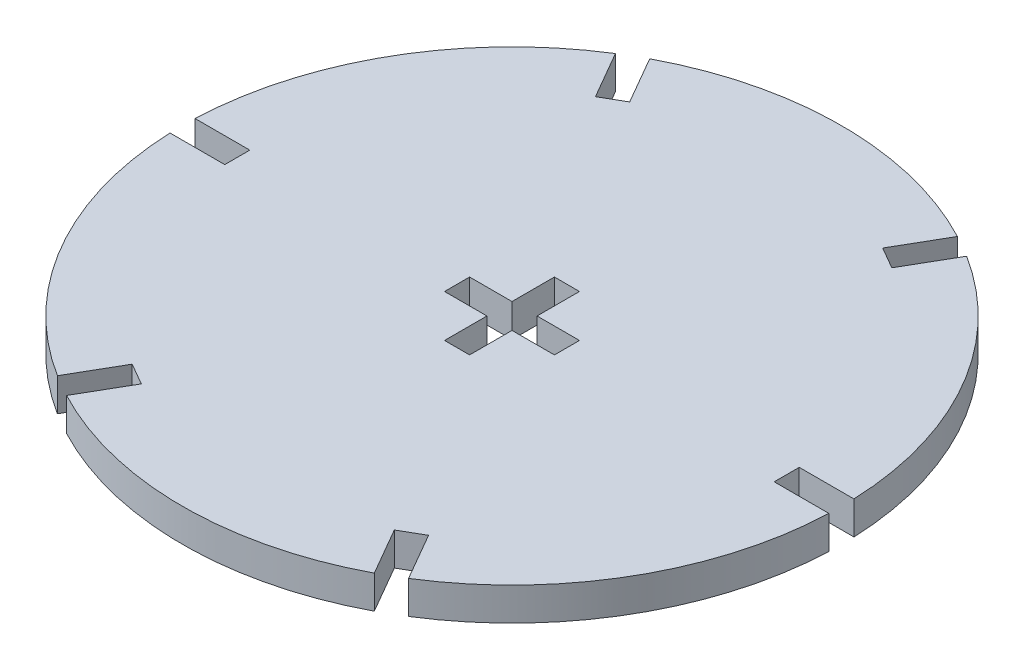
SolidWorks part; units mm, degrees
ref_plane "Alzado" through (0, 0, 0) normal (0, 0, 1) x (1, 0, 0)
ref_plane "Planta" through (0, 0, 0) normal (0, 1, 0) x (1, 0, 0)
ref_plane "Vista lateral" through (0, 0, 0) normal (1, 0, 0) x (0, 0, -1)
sketch "Sketch1" plane through (0, 0, 0) normal (0, 1, 0) x (1, 0, 0)
  line L0 (41.6729, 0) -> (-50.4513, 0) construction
  line L1 (-35, 1.14) -> (-25, 1.14)
  line L2 (-35, 1.14) -> (-35, -1.14)
  line L3 (-35, -1.14) -> (-25, -1.14)
  line L4 (-25, 1.14) -> (-25, -1.14)
  line L5 (-35, 1.14) -> (-25, -1.14) construction
  line L6 (-35, -1.14) -> (-25, 1.14) construction
  line L7 (-11.5127, 22.2206) -> (-13.4873, 21.0806)
  line L8 (-18.4873, 29.7409) -> (-13.4873, 21.0806)
  line L9 (-16.5127, 30.8809) -> (-18.4873, 29.7409)
  line L10 (-16.5127, 30.8809) -> (-11.5127, 22.2206)
  line L11 (13.4873, 21.0806) -> (11.5127, 22.2206)
  line L12 (16.5127, 30.8809) -> (11.5127, 22.2206)
  line L13 (18.4873, 29.7409) -> (16.5127, 30.8809)
  line L14 (18.4873, 29.7409) -> (13.4873, 21.0806)
  line L15 (25, -1.14) -> (25, 1.14)
  line L16 (35, 1.14) -> (25, 1.14)
  line L17 (35, -1.14) -> (35, 1.14)
  line L18 (35, -1.14) -> (25, -1.14)
  line L19 (11.5127, -22.2206) -> (13.4873, -21.0806)
  line L20 (18.4873, -29.7409) -> (13.4873, -21.0806)
  line L21 (16.5127, -30.8809) -> (18.4873, -29.7409)
  line L22 (16.5127, -30.8809) -> (11.5127, -22.2206)
  line L23 (-13.4873, -21.0806) -> (-11.5127, -22.2206)
  line L24 (-16.5127, -30.8809) -> (-11.5127, -22.2206)
  line L25 (-18.4873, -29.7409) -> (-16.5127, -30.8809)
  line L26 (-18.4873, -29.7409) -> (-13.4873, -21.0806)
  circle A0 centre (0, 0) radius 30
  point P3 (-30, 0)
  point P32 (0, 0)
extrude "Boss-Extrude1" add sketch "Sketch1" along normal blind 3 contours L20 A0 L18 L15 L16 L14 L11 L12 L10 L7 L8 L1 L4 L3 L26 L23 L24 L22 L19
sketch "Sketch2" plane through (0, 3, 0) normal (0, 1, 0) x (1, 0, 0)
  line L1 (-1.14, 5) -> (1.14, 5)
  line L2 (-1.14, 5) -> (-1.14, -5)
  line L3 (-1.14, -5) -> (1.14, -5)
  line L4 (1.14, 5) -> (1.14, -5)
  line L5 (-1.14, 5) -> (1.14, -5) construction
  line L6 (-1.14, -5) -> (1.14, 5) construction
  line L7 (-5, -1.14) -> (5, -1.14)
  line L8 (-5, -1.14) -> (-5, 1.14)
  line L9 (-5, 1.14) -> (5, 1.14)
  line L10 (5, -1.14) -> (5, 1.14)
  line L11 (-5, -1.14) -> (5, 1.14) construction
  line L12 (-5, 1.14) -> (5, -1.14) construction
  point P0 (0, 0)
  point P6 (0, 0)
extrude "Cut-Extrude1" cut sketch "Sketch2" against normal blind 10 contours L7 L10 L9 L8 | L4 L3 L2 L1
equation "\"d\"= 60mm"
equation "\"l\"= 2.28"
equation "\"a\"= 10mm"
equation "\"D2@Sketch1\"=\"a\""
equation "\"D1@Sketch1\"=\"l\""
equation "\"d@Sketch1\"=\"d\""
equation "\"rint\"= 2.28mm"
equation "\"D2@Sketch2\"=\"rint\""
equation "\"rina\"=10"
equation "\"D1@Sketch2\"=\"rina\""
equation "\"D4@Sketch2\"=\"l\""
equation "\"D3@Sketch2\"=\"a\""
